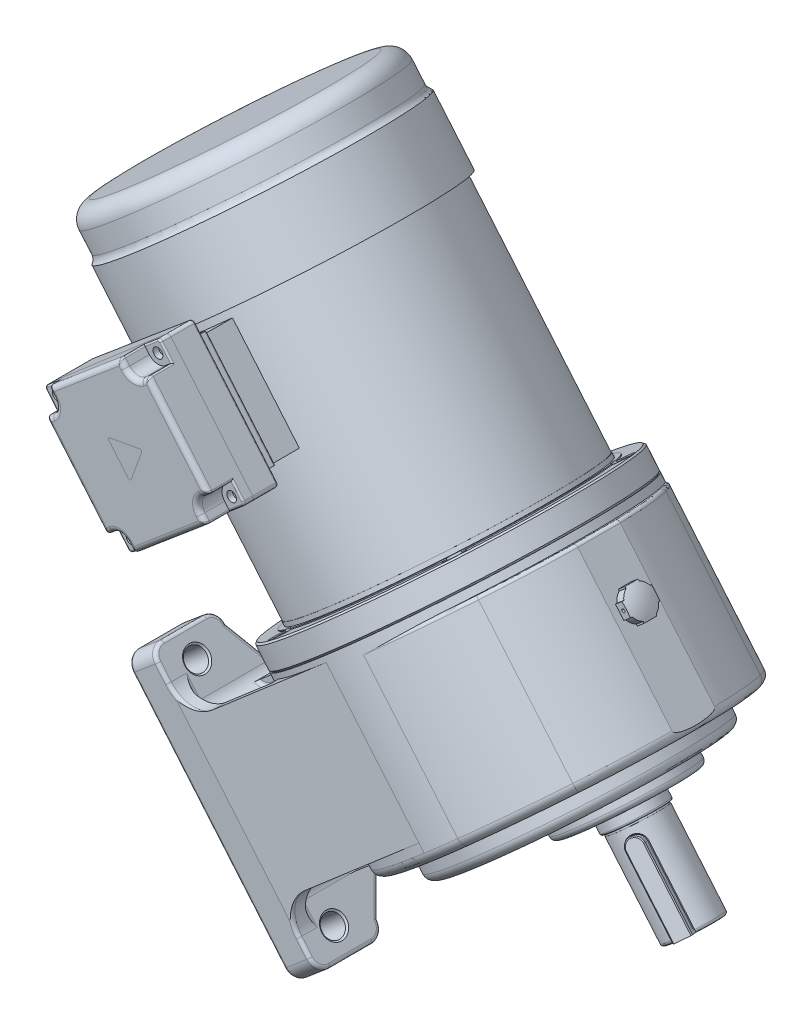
SolidWorks part; units mm, degrees
ref_plane "前视基准面" through (0, 0, 0) normal (0, 0, 1) x (1, 0, 0)
ref_plane "上视基准面" through (0, 0, 0) normal (0, 1, 0) x (1, 0, 0)
ref_plane "右视基准面" through (0, 0, 0) normal (1, 0, 0) x (0, 0, -1)
imported_body "接线盒座-1-surface1"
imported_body "接线盒座-1-surface2"
imported_body "接线盒座-1-surface3"
imported_body "接线盒座-1-surface4"
imported_body "接线盒座-1-surface5"
imported_body "接线盒盖-1-surface1"
imported_body "接线盒盖-1-surface2"
imported_body "接线盒盖-1-surface3"
imported_body "接线盒盖-1-surface4"
imported_body "32卧式装配体2-1/32卧式箱体-1-surface1"
imported_body "32卧式装配体2-1/32卧式箱体-1-surface2"
imported_body "32卧式装配体2-1/32卧式箱体-1-surface3"
imported_body "32卧式装配体2-1/32卧式箱体-1-surface4"
imported_body "32卧式装配体2-1/32卧式箱体-1-surface5"
imported_body "32卧式装配体2-1/32卧式箱体-1-surface6"
imported_body "32卧式装配体2-1/32卧式箱体-1-surface7"
imported_body "32卧式装配体2-1/32卧式箱体-1-surface8"
imported_body "32卧式装配体2-1/32卧式箱体-1-surface9"
imported_body "32卧式装配体2-1/32卧式箱体-1-surface10"
imported_body "32卧式装配体2-1/32卧式箱体-1-surface11"
imported_body "32卧式装配体2-1/32卧式箱体-1-surface12"
imported_body "32卧式装配体2-1/32卧式箱体-1-surface13"
imported_body "32卧式装配体2-1/32卧式箱体-1-surface14"
imported_body "32卧式装配体2-1/32卧式箱体-1-surface15"
imported_body "32卧式装配体2-1/C10X50-1-surface1"
imported_body "32卧式装配体2-1/透气塞-1-surface1"
imported_body "透气塞-1-surface1"
sketch "草图1" plane through (26.1741, -31.0648, 0) normal (-0.6443, 0.7647, 0) x (0.7647, 0.6443, 0)
  circle A0 centre (-40.9074, 78.118) radius 80
extrude "凸台-拉伸1" add sketch "草图1" along normal blind 136
sketch "草图2" plane through (-61.4563, 72.9396, 0) normal (-0.6443, 0.7647, 0) x (0.7647, 0.6443, 0)
  circle A0 centre (-40.9074, 78.118) radius 83
extrude "凸台-拉伸2" add sketch "草图2" along normal blind 39
sketch "草图3" plane through (-86.5856, 102.7644, 0) normal (-0.6443, 0.7647, 0) x (0.7647, 0.6443, 0)
  circle A0 centre (-40.9074, 78.118) radius 81
extrude "凸台-拉伸3" add sketch "草图3" along normal blind 26
fillet "圆角1" radius 10 1 edges at (-196.5658, 44.0976, -78.118)
fillet "圆角2" radius 5 1 edges at (-179.8129, 24.2145, -78.118)
